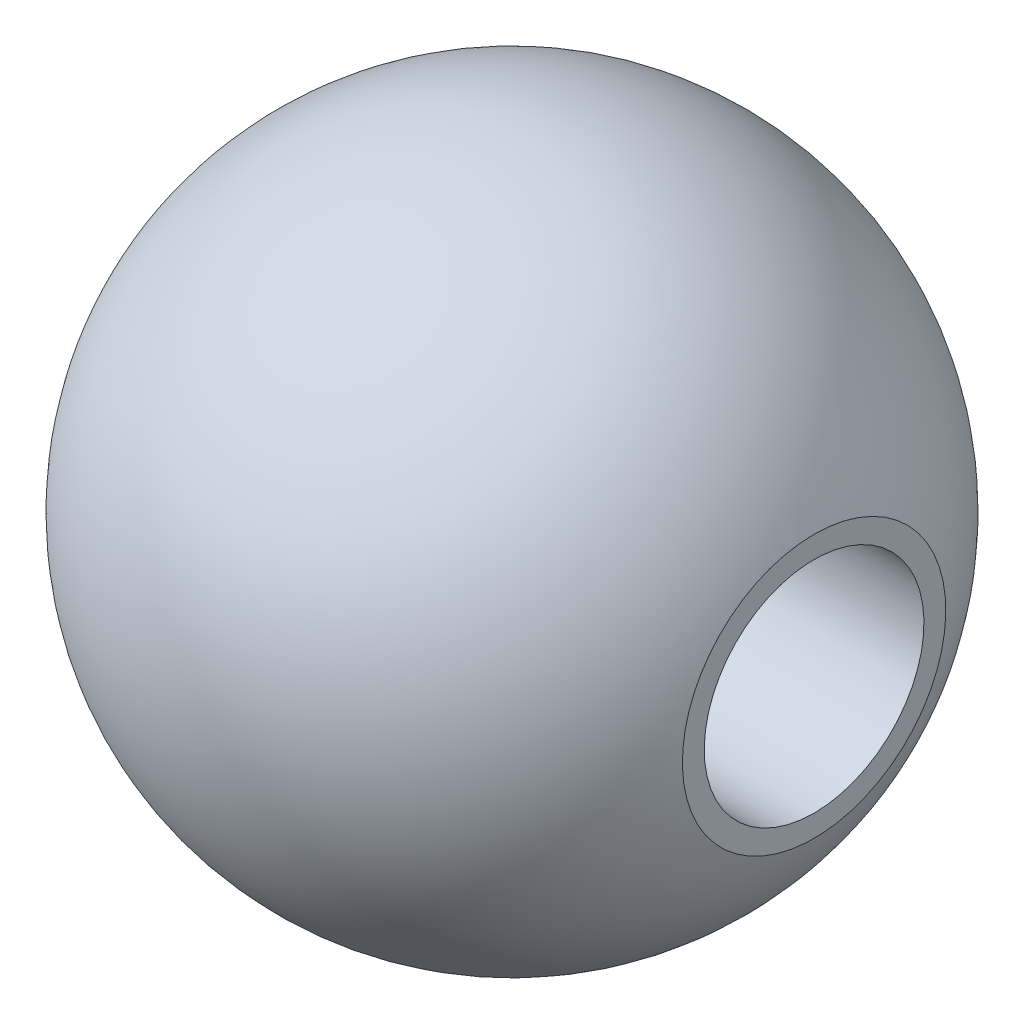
SolidWorks part; units mm, degrees
ref_plane "Front Plane" through (0, 0, 0) normal (0, 0, 1) x (1, 0, 0)
ref_plane "Top Plane" through (0, 0, 0) normal (0, 1, 0) x (1, 0, 0)
ref_plane "Right Plane" through (0, 0, 0) normal (1, 0, 0) x (0, 0, -1)
sketch "Sketch2" plane through (0, 0, 0) normal (0, 0, 1) x (1, 0, 0)
  line L0 (-5.5, 0) -> (5.5, 0)
  line L2 (-5.5, 0) -> (-5.5, 2.3979)
  line L4 (5.5, 0) -> (5.5, 2.3979)
  arc A1 (5.5, 2.3979) -> (-5.5, 2.3979) centre (0, 0) ccw
  point P1 (0, 0)
  dimension "D1" = 6
  dimension "D2" = 11
revolve "Revolve2" add sketch "Sketch2" angle 360 about L0
sketch "Sketch1" plane through (0, 0, 0) normal (0, 0, 1) x (1, 0, 0)
  line L0 (-7, 0) -> (0, 0)
  line L1 (5.3619, 4.5) -> (5.3619, 2)
  line L2 (5.3619, 2) -> (0, 2)
  line L3 (0, 2) -> (0, 0)
  arc A0 (5.3619, 4.5) -> (-7, 0) centre (0, 0) ccw
  dimension "D1" = 7
  dimension "D2" = 2
  dimension "D3" = 2.5
revolve "Revolve1" [suppressed] add sketch "Sketch1" angle 360 about L0
sketch "Sketch3" plane through (0, 0, 0) normal (0, 0, 1) x (1, 0, 0)
  line L0 (-5.5, 0) -> (5.5, 0)
  line L1 (-5.5, 2.3979) -> (-5.5, -2.3979) construction
  line L2 (5.5, -2.3979) -> (5.5, 2.3979) construction
  line L3 (5.5, 0) -> (5.5, 2)
  line L4 (5.5, 2) -> (-4.5, 2)
  line L5 (-4.5, 2) -> (-5.5, 3)
  line L6 (-5.5, 3) -> (-5.5, 0)
  dimension "D1" = 1
  dimension "D2" = 45
  dimension "D3" = 2
revolve "Cut-Revolve1" cut sketch "Sketch3" angle 360 about L0
